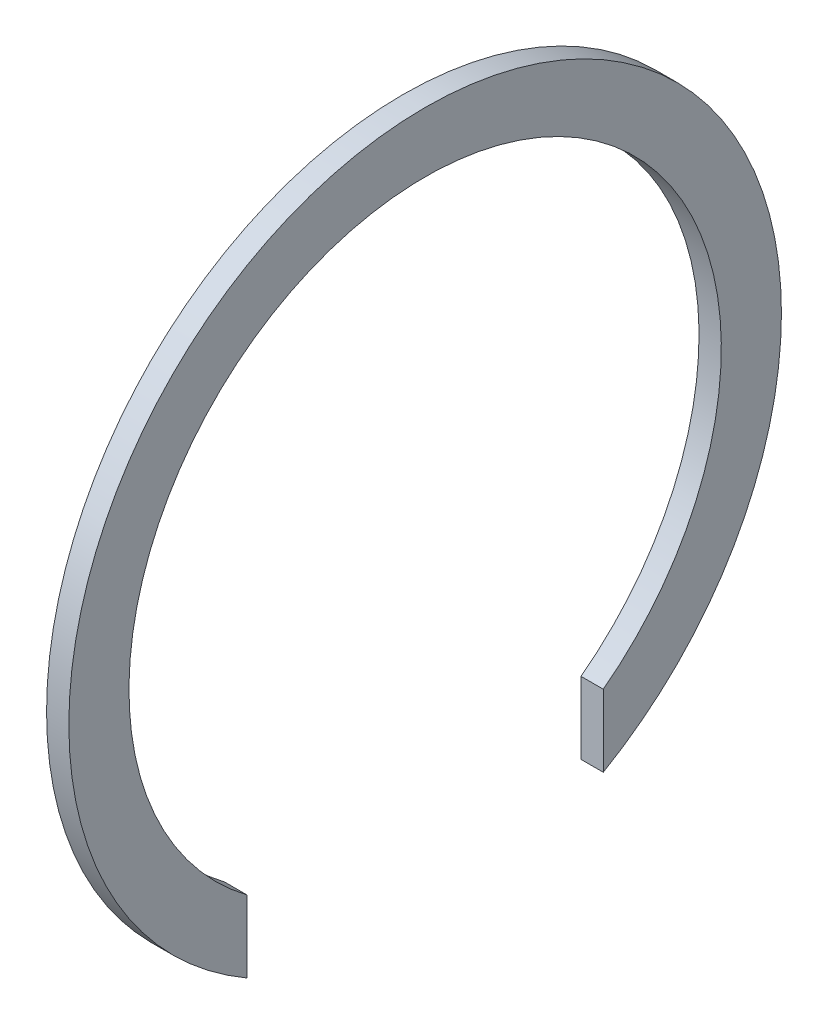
SolidWorks part; units mm, degrees
ref_plane "Plan de Face" through (0, 0, 0) normal (0, 0, 1) x (1, 0, 0)
ref_plane "Plan de Dessus" through (0, 0, 0) normal (0, 1, 0) x (1, 0, 0)
ref_plane "Plan de Droite" through (0, 0, 0) normal (1, 0, 0) x (0, 0, -1)
sketch "Esquisse1" plane through (0, 0, 0) normal (1, 0, 0) x (0, 0, -1)
  line L0 (0, 0) -> (0, -8.2999) construction
  line L1 (-4, -5.3125) -> (-4, -6.9282)
  line L2 (4, -5.3125) -> (4, -6.9282)
  arc A0 (4, -5.3125) -> (-4, -5.3125) centre (0, 0) ccw
  arc A1 (4, -6.9282) -> (-4, -6.9282) centre (0, 0) ccw
  dimension "D1" = 16
  dimension "D2" = 13.3
  dimension "D3" = 8
extrude "Extrusion1" add sketch "Esquisse1" along normal blind 0.5
